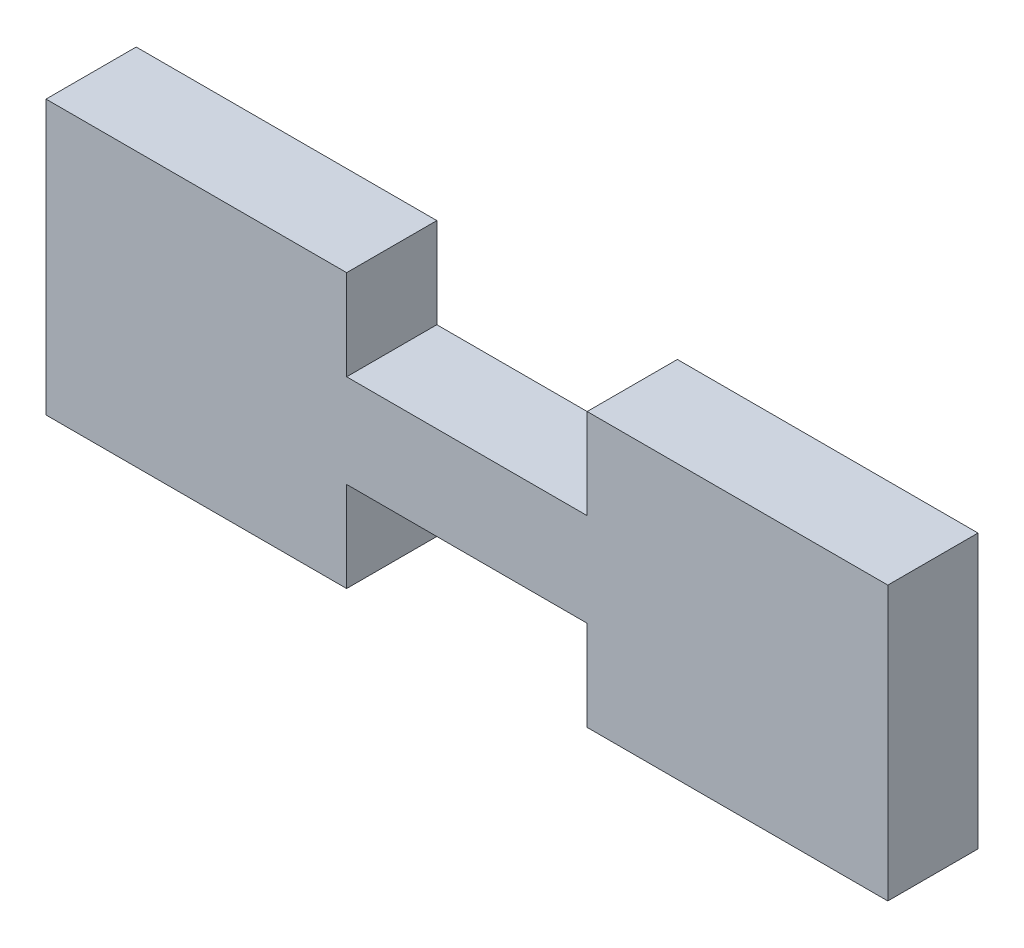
SolidWorks part; units mm, degrees
ref_plane "Plan de face" through (0, 0, 0) normal (0, 0, 1) x (1, 0, 0)
ref_plane "Plan de dessus" through (0, 0, 0) normal (0, 1, 0) x (1, 0, 0)
ref_plane "Plan de droite" through (0, 0, 0) normal (1, 0, 0) x (0, 0, -1)
sketch "Esquisse1" plane through (0, 0, 0) normal (0, 0, 1) x (1, 0, 0)
  line L0 (12.3847, -3) -> (12.3847, 6.1)
  line L1 (12.3847, 6.1) -> (22.3847, 6.1)
  line L2 (22.3847, 6.1) -> (22.3847, 3.1)
  line L3 (22.3847, 3.1) -> (30.3847, 3.1)
  line L4 (30.3847, 3.1) -> (30.3847, 6.1)
  line L5 (30.3847, 6.1) -> (40.3847, 6.1)
  line L6 (40.3847, 6.1) -> (40.3847, -3)
  line L7 (40.3847, -3) -> (30.3847, -3)
  line L8 (30.3847, -3) -> (30.3847, 0)
  line L9 (30.3847, 0) -> (22.3847, 0)
  line L10 (22.3847, 0) -> (22.3847, -3)
  line L11 (22.3847, -3) -> (12.3847, -3)
extrude "Boss.-Extru.1" add sketch "Esquisse1" along normal blind 3
